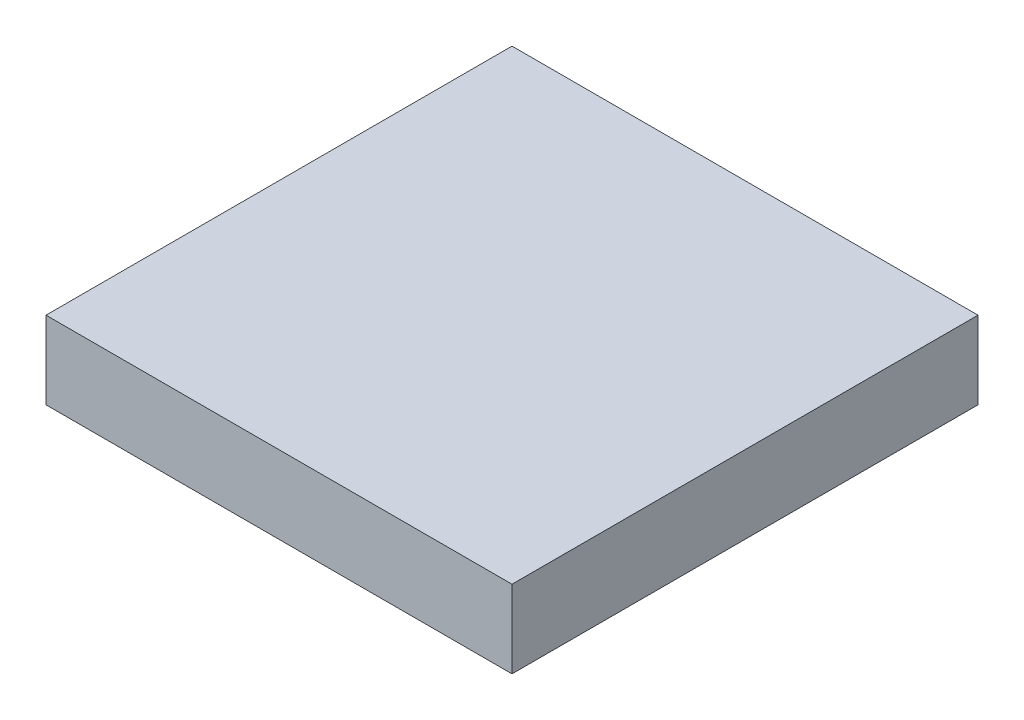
SolidWorks part; units mm, degrees
ref_plane "Plan de face" through (0, 0, 0) normal (0, 0, 1) x (1, 0, 0)
ref_plane "Plan de dessus" through (0, 0, 0) normal (0, 1, 0) x (1, 0, 0)
ref_plane "Plan de droite" through (0, 0, 0) normal (1, 0, 0) x (0, 0, -1)
sketch "Esquisse1" plane through (0, 0, 0) normal (0, 0, 1) x (1, 0, 0)
  line L1 (0, 0) -> (30, 0)
  line L2 (0, 0) -> (0, 5)
  line L3 (0, 5) -> (30, 5)
  line L4 (30, 0) -> (30, 5)
  dimension "D1" = 30
  dimension "D2" = 5
extrude "Extrusion1" add sketch "Esquisse1" along normal blind 30
